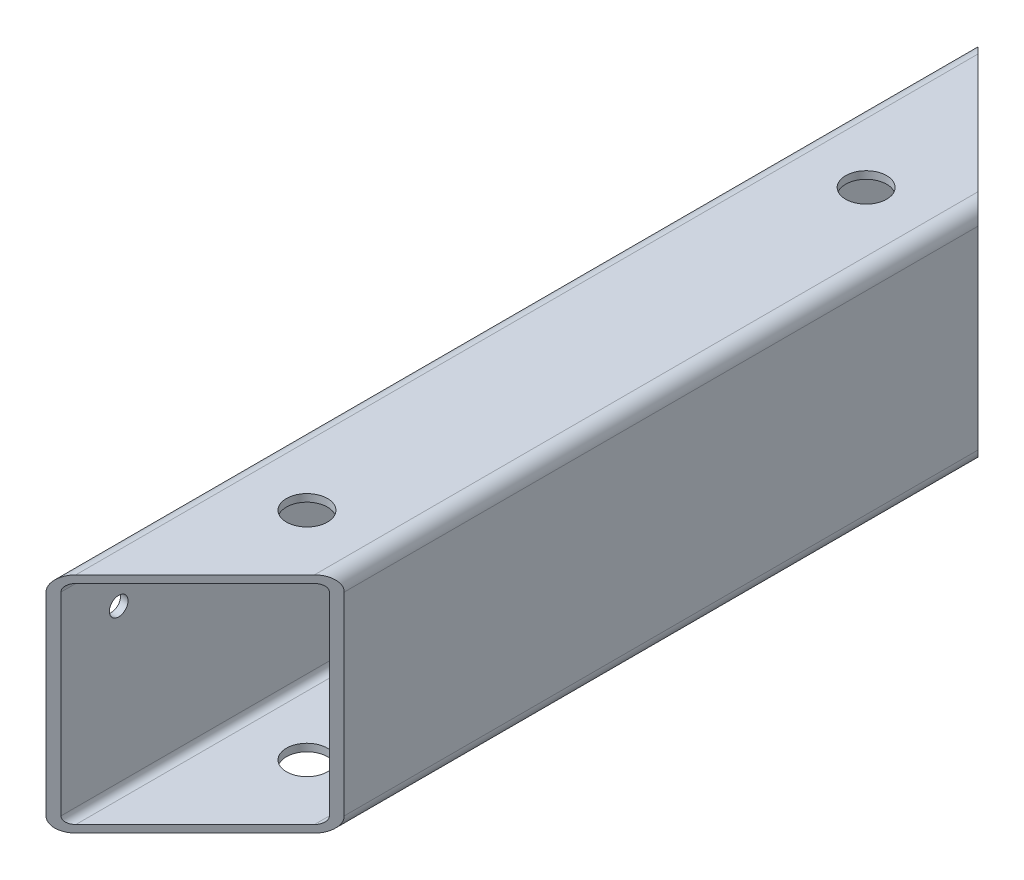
SolidWorks part; units mm, degrees
ref_plane "Plan1" through (0, 0, 0) normal (0, 0, 1) x (1, 0, 0)
ref_plane "Plan2" through (0, 0, 0) normal (0, 1, 0) x (1, 0, 0)
ref_plane "Plan3" through (0, 0, 0) normal (1, 0, 0) x (0, 0, -1)
sketch "Esquisse1" plane through (0, 0, 0) normal (0, 0, 1) x (1, 0, 0)
  line L0 (0, 10.0463) -> (0, -10.0463) construction
  line L1 (-16, -30) -> (16, -30)
  line L2 (-20, -26) -> (-20, 26)
  line L3 (-16, 30) -> (16, 30)
  line L4 (20, -26) -> (20, 26)
  line L5 (-5.6581, 0) -> (5.6581, 0) construction
  arc A0 (-16, 30) -> (-20, 26) centre (-16, 26) ccw
  arc A1 (-20, -26) -> (-16, -30) centre (-16, -26) ccw
  arc A2 (20, -26) -> (16, -30) centre (16, -26) cw
  arc A3 (20, 26) -> (16, 30) centre (16, 26) ccw
  dimension "D1" = 4
  dimension "D2" = 40
  dimension "D3" = 60
extrude "Base-Extru.-Mince" add sketch "Esquisse1" along normal mid plane 250 thin
sketch "Esquisse2" plane through (0, 30, 0) normal (0, 1, 0) x (-1, 0, 0)
  line L0 (20, -125) -> (-20, -85)
  line L1 (-16, -125) -> (16, -125) construction
  line L2 (-20, -125) -> (20, -125)
  line L3 (-20, 125) -> (-20, -125) construction
  line L4 (-20, -85) -> (-20, -125)
  line L5 (20, 125) -> (-20, 85)
  line L6 (-16, 125) -> (16, 125) construction
  line L7 (-20, 125) -> (20, 125)
  line L8 (-20, 125) -> (-20, 85)
  line L9 (20, 125) -> (20, -125) construction
  dimension "D1" = 45
  dimension "D2" = 45
extrude "Enlèv. mat.-Extru.1" cut sketch "Esquisse2" against normal blind 60
sketch "Esquisse3" plane through (-20, 0, 0) normal (-1, 0, 0) x (0, 0, 1)
  line L0 (0, 56.4143) -> (0, -56.4143) construction
  line L1 (121, -30) -> (-121, -30) construction
  circle A0 centre (0, -15) radius 2.5
  circle A1 centre (107.5, 15) radius 2.5
  circle A2 centre (-107.5, 15) radius 2.5
  dimension "D1" = 215
  dimension "D2" = 15
  dimension "D3" = 45
  dimension "D4" = 5
extrude "Enlèv. mat.-Extru.2" cut sketch "Esquisse3" against normal up to next
sketch "Esquisse5" plane through (0, 0, 0) normal (0, 1, 0) x (1, 0, 0)
  line L0 (-20, -125) -> (-20, 125) construction
  line L1 (-34.4043, 0) -> (34.4043, 0) construction
  circle A0 centre (0, -75) radius 5.5
  circle A1 centre (0, 75) radius 5.5
  dimension "D1" = 150
  dimension "D2" = 20
  dimension "D3" = 11
extrude "Enlèv. mat.-Extru.3" cut sketch "Esquisse5" against normal through all and the other way through all
